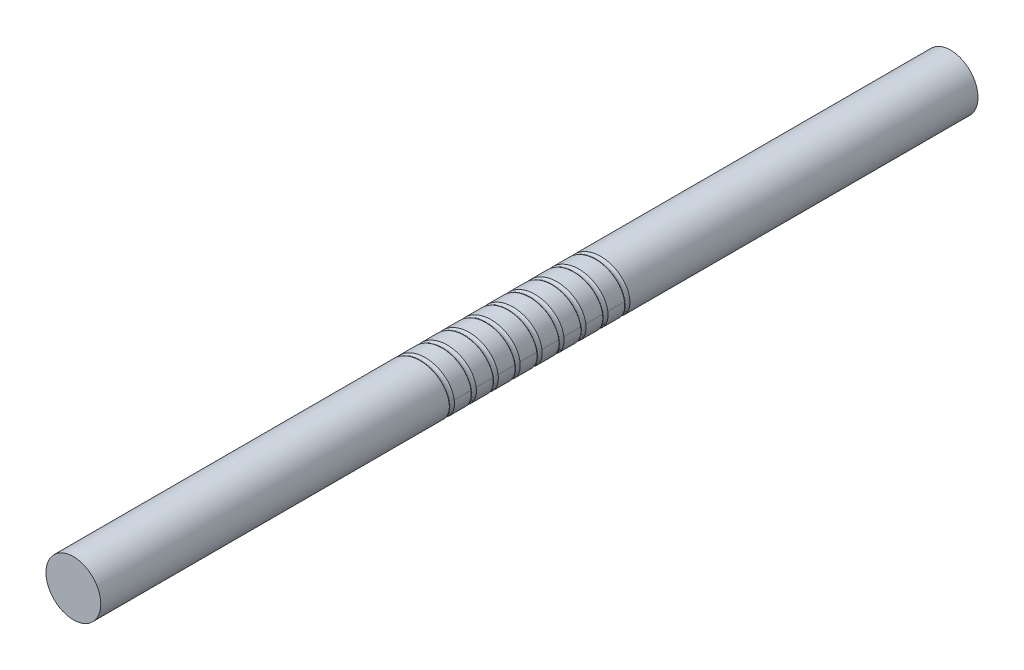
SolidWorks part; units mm, degrees
ref_plane "Front Plane" through (0, 0, 0) normal (0, 0, 1) x (1, 0, 0)
ref_plane "Top Plane" through (0, 0, 0) normal (0, 1, 0) x (1, 0, 0)
ref_plane "Right Plane" through (0, 0, 0) normal (1, 0, 0) x (0, 0, -1)
sketch "Sketch1" plane through (0, 0, 0) normal (0, 0, 1) x (1, 0, 0)
  circle A0 centre (0, 0) radius 25
  dimension "D1" = 50
extrude "Boss-Extrude1" add sketch "Sketch1" along normal blind 800
ref_plane "Plane1" through (0, 0, 310) normal (0, 0, 1) x (1, 0, 0)
sketch "Sketch2" plane through (0, 0, 310) normal (0, 0, 1) x (1, 0, 0)
  circle A0 centre (0, 0) radius 27.1167
  dimension "D1" = 54.2333
curve "Helix/Spiral1"
sketch "Sketch3" plane through (0, 0, 0) normal (0, 1, 0) x (1, 0, 0)
  circle A0 centre (-27.1167, -310) radius 3.175
  spline S0 degree 3 number of poles 209 (-27.1167, -310) -> (-27.1167, -490) construction
  dimension "D1" = 6.35
sweep "Cut-Sweep1" cut profiles "Sketch3" path "Helix/Spiral1"
pattern_linear "LPattern1" [suppressed] count 2 spacing 500
